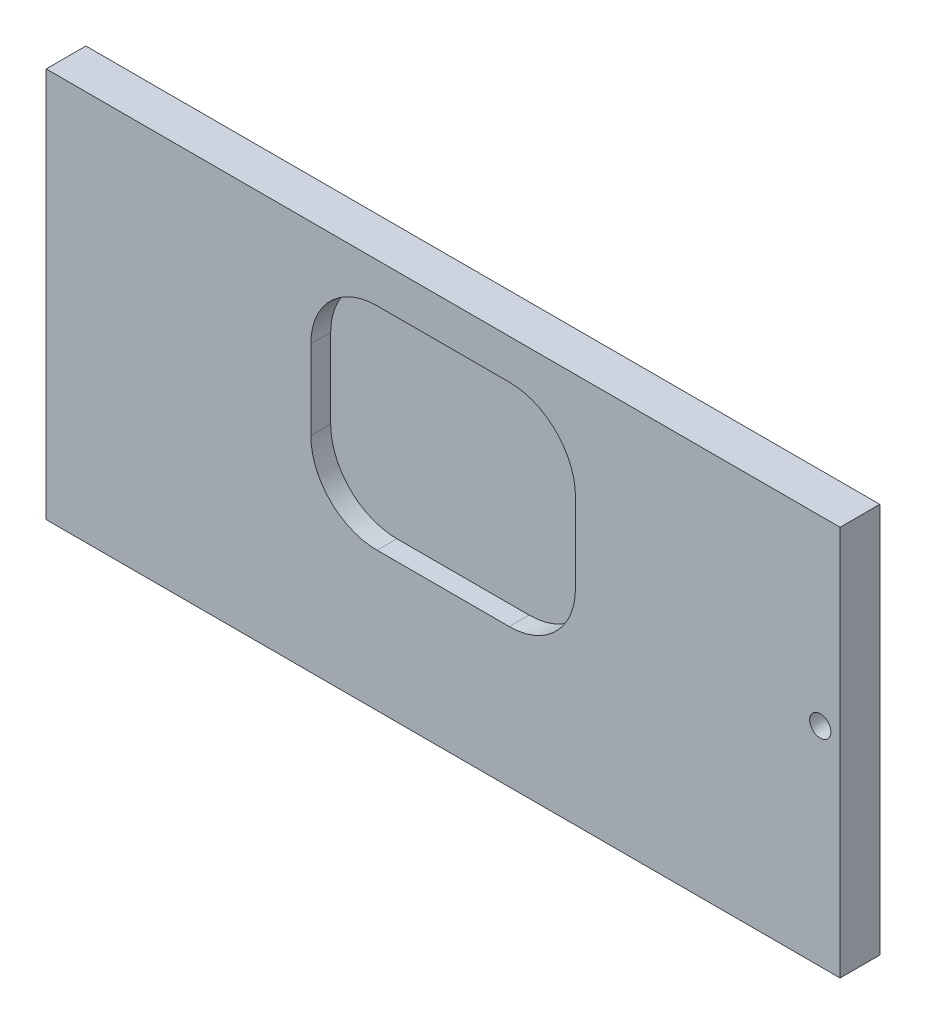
SolidWorks part; units mm, degrees
ref_plane "Plan de face" through (0, 0, 0) normal (0, 0, 1) x (1, 0, 0)
ref_plane "Plan de dessus" through (0, 0, 0) normal (0, 1, 0) x (1, 0, 0)
ref_plane "Plan de droite" through (0, 0, 0) normal (1, 0, 0) x (0, 0, -1)
sketch "Esquisse1" plane through (0, 0, 0) normal (0, 0, 1) x (1, 0, 0)
  line L1 (-50, 30) -> (70, 30)
  line L2 (-50, 30) -> (-50, -29)
  line L3 (-50, -29) -> (70, -29)
  line L4 (70, 30) -> (70, -29)
  dimension "D1" = 120
  dimension "D2" = 59
extrude "Extrusion1" add sketch "Esquisse1" along normal blind 6
sketch "Esquisse2" plane through (0, 0, 6) normal (0, 0, 1) x (1, 0, 0)
  line L1 (-10, 24) -> (30, 24)
  line L2 (-10, 24) -> (-10, -8)
  line L3 (-10, -8) -> (30, -8)
  line L4 (30, 24) -> (30, -8)
  line L6 (-50, 30) -> (-50, -29) construction
  line L8 (70, 30) -> (-50, 30) construction
  dimension "D1" = 32
  dimension "D2" = 6
  dimension "D3" = 40
  dimension "D4" = 40
extrude "Enlèv. mat.-Extru.1" cut sketch "Esquisse2" against normal blind 3
fillet "Congé1" radius 10 4 edges at (-10, -8, 4.5) (-10, 24, 4.5) (30, 24, 4.5) (30, -8, 4.5)
sketch "Esquisse3" plane through (0, 0, 6) normal (0, 0, 1) x (1, 0, 0)
  line L0 (70, -29) -> (70, 30) construction
  line L1 (70, 30) -> (-50, 30) construction
  circle A0 centre (67, 2.5) radius 1.6
  dimension "D1" = 3
  dimension "D2" = 27.5
extrude "Enlèv. mat.-Extru.2" cut sketch "Esquisse3" against normal through all
